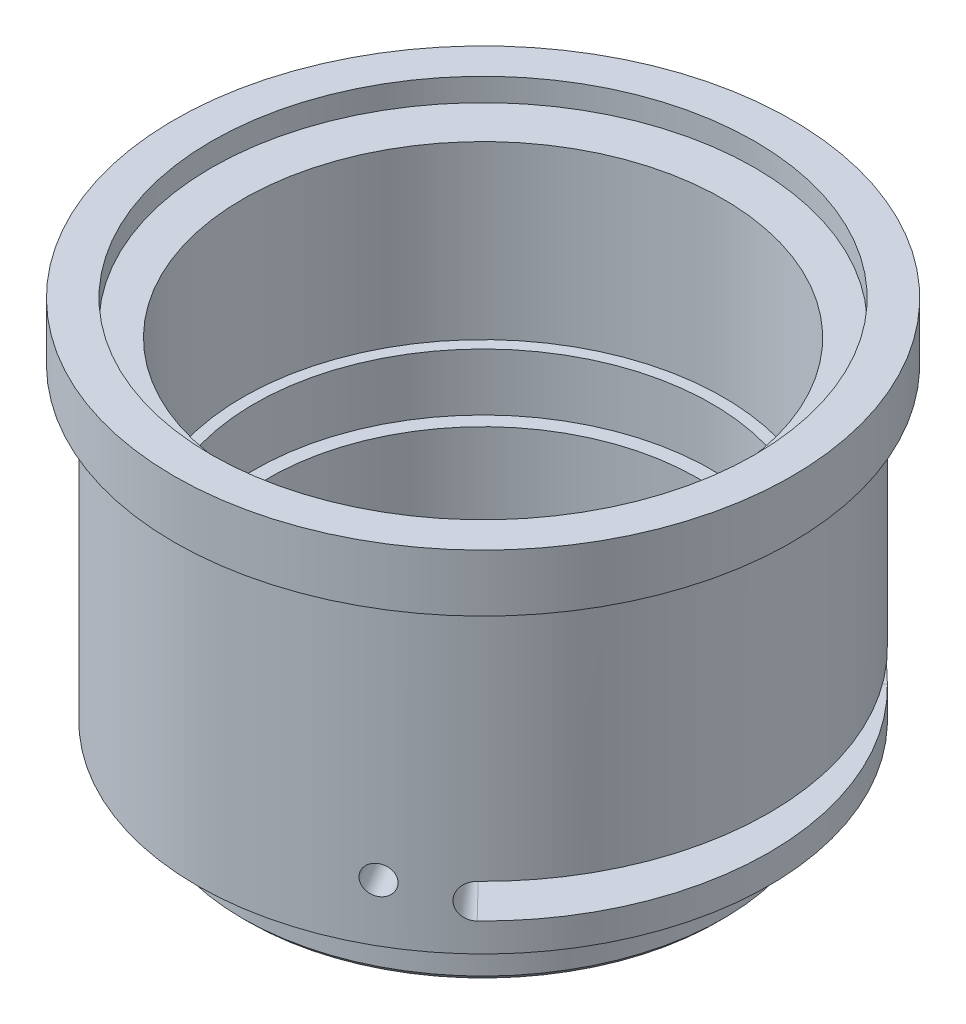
SolidWorks part; units mm, degrees
ref_plane "Front Plane" through (0, 0, 0) normal (0, 0, 1) x (1, 0, 0)
ref_plane "Top Plane" through (0, 0, 0) normal (0, 1, 0) x (1, 0, 0)
ref_plane "Right Plane" through (0, 0, 0) normal (1, 0, 0) x (0, 0, -1)
sketch "Sketch1" plane through (0, 0, 0) normal (0, 1, 0) x (1, 0, 0)
  circle A0 centre (0, 0) radius 21
  dimension "D1" = 42
extrude "Boss-Extrude1" add sketch "Sketch1" along normal blind 5
sketch "Sketch2" plane through (0, 5, 0) normal (0, 1, 0) x (1, 0, 0)
  circle A0 centre (0, 0) radius 25
  dimension "D1" = 50
extrude "Boss-Extrude2" add sketch "Sketch2" along normal blind 27
sketch "Sketch3" plane through (0, 32, 0) normal (0, 1, 0) x (1, 0, 0)
  circle A0 centre (0, 0) radius 27
  dimension "D1" = 54
extrude "Boss-Extrude3" add sketch "Sketch3" along normal blind 5
sketch "Sketch4" plane through (0, 37, 0) normal (0, 1, 0) x (1, 0, 0)
  circle A0 centre (0, 0) radius 23.75
  dimension "D1" = 47.5
extrude "Cut-Extrude1" cut sketch "Sketch4" against normal blind 3
sketch "Sketch5" plane through (0, 34, 0) normal (0, 1, 0) x (1, 0, 0)
  circle A0 centre (0, 0) radius 21
  dimension "D1" = 42
extrude "Cut-Extrude2" cut sketch "Sketch5" against normal blind 15
sketch "Sketch6" plane through (0, 19, 0) normal (0, 1, 0) x (1, 0, 0)
  circle A0 centre (0, 0) radius 20
  dimension "D1" = 40
extrude "Cut-Extrude3" cut sketch "Sketch6" against normal blind 5
sketch "Sketch7" plane through (0, 14, 0) normal (0, 1, 0) x (1, 0, 0)
  circle A0 centre (0, 0) radius 18.75
  dimension "D1" = 37.5
extrude "Cut-Extrude4" cut sketch "Sketch7" against normal blind 8
sketch "Sketch8" plane through (0, 0, 0) normal (0, -1, 0) x (1, 0, 0)
  circle A0 centre (0, 0) radius 18
  dimension "D1" = 36
extrude "Cut-Extrude5" cut sketch "Sketch8" against normal through all
sketch "Sketch9" plane through (0, 0, 0) normal (1, 0, 0) x (0, 0, -1)
  line L0 (0, 0) -> (0, -4.4254) construction
  line L1 (-21, 5) -> (-20, 5)
  line L2 (-21, 5) -> (-21, 4)
  line L3 (-21, 4) -> (-20, 4)
  line L4 (-20, 5) -> (-20, 4)
  dimension "D1" = 1
  dimension "D2" = 1
revolve "Cut-Revolve1" cut sketch "Sketch9" angle 360 about L0
sketch "Sketch12" plane through (0, 0, 0) normal (1, 0, 0) x (0, 0, -1)
  line L0 (-20, 9) -> (20, 9) construction
  line L1 (-20, 10.5) -> (20, 10.5)
  line L2 (-20, 7.5) -> (20, 7.5)
  line L3 (-21, 0) -> (21, 0) construction
  arc A0 (-20, 10.5) -> (-20, 7.5) centre (-20, 9) ccw
  arc A1 (20, 7.5) -> (20, 10.5) centre (20, 9) ccw
  point P2 (0, 9)
  dimension "D1" = 1.5
  dimension "D2" = 40
  dimension "D3" = 0
  dimension "D4" = 9
wrap "Wrap1" sketch "Sketch12" wrap type deboss source sketch "Sketch12" thickness 7 parameters "D1"=7
hole_wizard "M3x0.5 Tapped Hole1" positions "Sketch15" profile "Sketch14" tap size "M3x0.5" standard "ANSI Metric"
sketch "Sketch15" plane through (0, 0, 0) normal (1, 0, 0) x (0, 0, -1)
  line L0 (-20, 5) -> (20, 5) construction
  line L1 (0, 0) -> (0, 10) construction
  point P0 (0, 10)
  dimension "D1" = 5
sketch "Sketch14" plane through (0, 10, 0) normal (0, 1, 0) x (0, 0, -1)
  line L0 (0, 0) -> (0, 36.8827)
  line L1 (0, 36.8827) -> (1.25, 36.8827)
  line L2 (1.25, 36.8827) -> (1.25, 0)
  line L5 (1.25, 0) -> (0, 0)
  line L11 (0, -6.35) -> (0, 107.95) construction
  dimension "Thru Tap Drill Dia." = 2.5
  dimension "Thru Tap Drill Depth" = 36.8827
pattern_circular "CirPattern1" count 3 over 360 about axis through (0, 19, 0) along (0, 1, 0) of "M3x0.5 Tapped Hole1"
sketch "Sketch16" plane through (0, 0, 0) normal (1, 0, 0) x (0, 0, -1)
  line L1 (-23.75, 34) -> (-25.25, 34)
  line L2 (-23.75, 34) -> (-23.75, 35)
  line L3 (-23.75, 35) -> (-25.25, 35)
  line L4 (-25.25, 34) -> (-25.25, 35)
  dimension "D1" = 1
  dimension "D2" = 1.5
revolve "Cut-Revolve2" cut sketch "Sketch16" angle 360 about axis through (0, 19, 0) along (0, 1, 0)
chamfer "Chamfer1" distance 0.5 angle 45 1 edges at (0, 0, 21)
